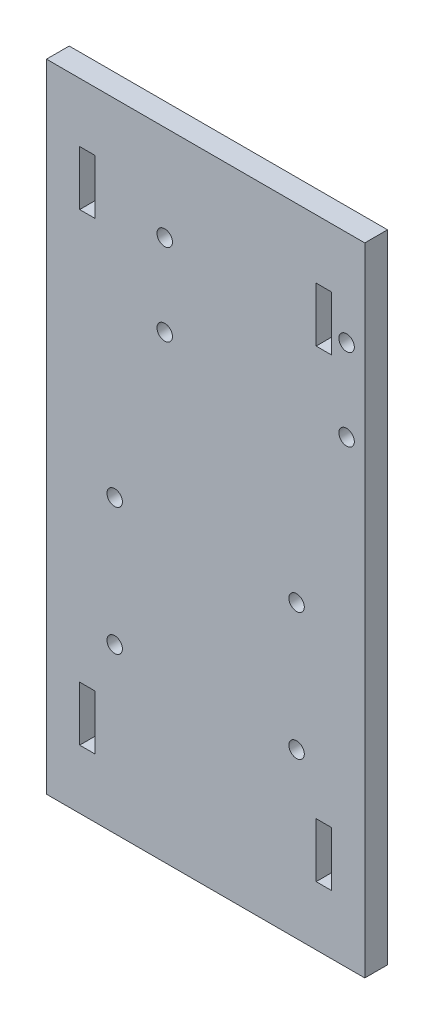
SolidWorks part; units mm, degrees
ref_plane "前视基准面" through (0, 0, 0) normal (0, 0, 1) x (1, 0, 0)
ref_plane "上视基准面" through (0, 0, 0) normal (0, 1, 0) x (1, 0, 0)
ref_plane "右视基准面" through (0, 0, 0) normal (1, 0, 0) x (0, 0, -1)
other "Configuration Table"
sketch "草图1" plane through (0, 0, 0) normal (0, 0, 1) x (1, 0, 0)
  line L1 (-35, -70) -> (35, -70)
  line L2 (-35, -70) -> (-35, 70)
  line L3 (-35, 70) -> (35, 70)
  line L4 (35, -70) -> (35, 70)
extrude "Base_70x140x5" add sketch "草图1" along normal blind 5
sketch "草图2" plane through (0, 0, 0) normal (0, 0, 1) x (1, 0, 0)
  line L1 (-27.7, -57) -> (-24.3, -57)
  line L2 (-27.7, -57) -> (-27.7, -45)
  line L3 (-27.7, -45) -> (-24.3, -45)
  line L4 (-24.3, -57) -> (-24.3, -45)
  line L6 (-27.7, 45) -> (-24.3, 45)
  line L7 (-27.7, 45) -> (-27.7, 57)
  line L8 (-27.7, 57) -> (-24.3, 57)
  line L9 (-24.3, 45) -> (-24.3, 57)
  line L11 (24.3, -57) -> (27.7, -57)
  line L12 (24.3, -57) -> (24.3, -45)
  line L13 (24.3, -45) -> (27.7, -45)
  line L14 (27.7, -57) -> (27.7, -45)
  line L16 (24.3, 45) -> (27.7, 45)
  line L17 (24.3, 45) -> (24.3, 57)
  line L18 (24.3, 57) -> (27.7, 57)
  line L19 (27.7, 45) -> (27.7, 57)
extrude "Chassis_adjustment_slots_UNVERIFIED_positions" cut sketch "草图2" against normal through all and the other way through all
sketch "草图3" plane through (0, 0, 0) normal (0, 0, 1) x (1, 0, 0)
  circle A0 centre (-20, -34) radius 1.7
  circle A1 centre (-20, -6) radius 1.7
  circle A2 centre (20, -34) radius 1.7
  circle A3 centre (20, -6) radius 1.7
  circle A4 centre (-9, 31) radius 1.7
  circle A5 centre (-9, 49) radius 1.7
  circle A6 centre (31, 31) radius 1.7
  circle A7 centre (31, 49) radius 1.7
extrude "Support_and_servo_mount_M3_clearance" cut sketch "草图3" against normal through all and the other way through all
